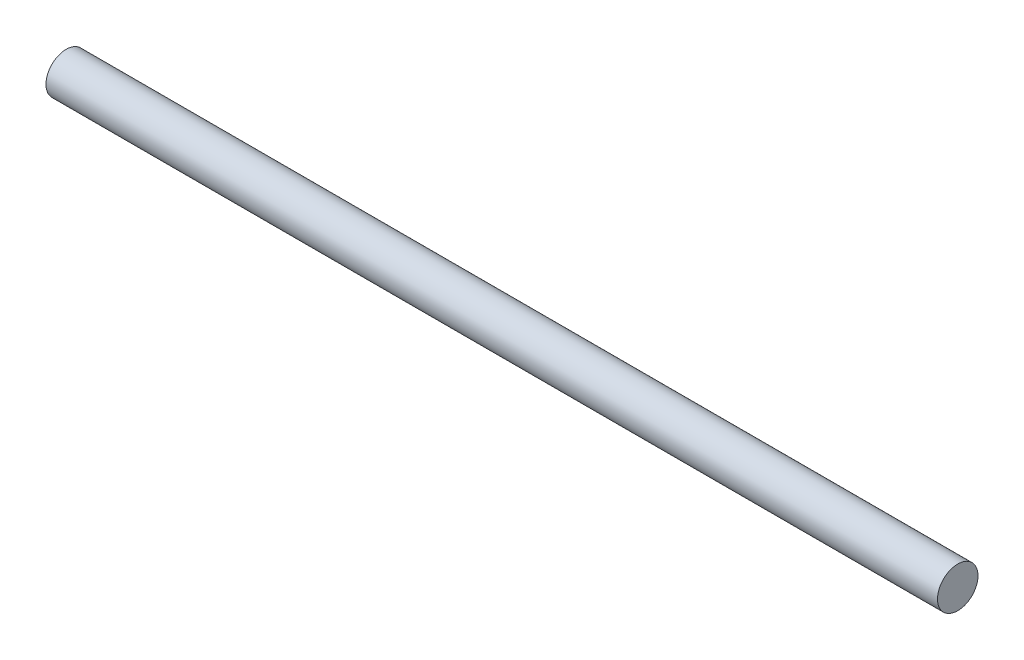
SolidWorks part; units mm, degrees
ref_plane "Front Plane" through (0, 0, 0) normal (0, 0, 1) x (1, 0, 0)
ref_plane "Top Plane" through (0, 0, 0) normal (0, 1, 0) x (1, 0, 0)
ref_plane "Right Plane" through (0, 0, 0) normal (1, 0, 0) x (0, 0, -1)
sketch "Sketch1" plane through (0, 0, 0) normal (1, 0, 0) x (0, 0, -1)
  circle A0 centre (0, 0) radius 5
extrude "Boss-Extrude1" add sketch "Sketch1" along normal blind 220
